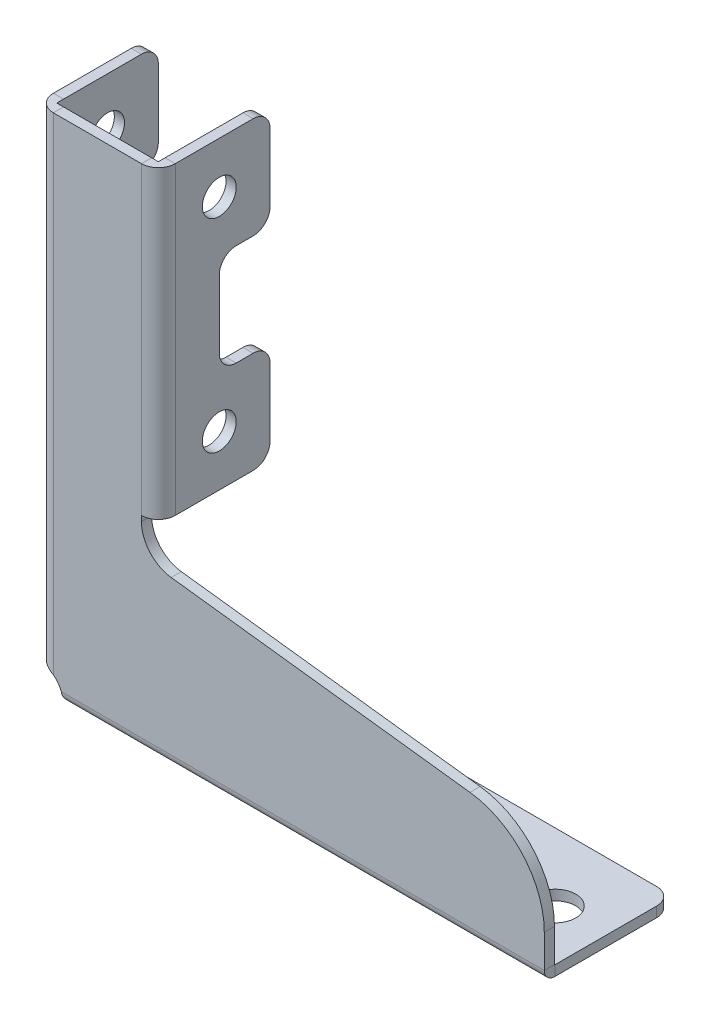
SolidWorks part; units mm, degrees
ref_plane "正面" through (0, 0, 0) normal (0, 0, 1) x (1, 0, 0)
ref_plane "平面" through (0, 0, 0) normal (0, 1, 0) x (1, 0, 0)
ref_plane "右側面" through (0, 0, 0) normal (1, 0, 0) x (0, 0, -1)
sketch "ｽｹｯﾁ1" plane through (0, 0, 0) normal (0, 0, 1) x (1, 0, 0)
  line L0 (114.2253, 30.6675) -> (25.9598, 41.5051)
  line L1 (-42.3215, 142.9719) -> (50.6785, 142.9719)
  line L2 (-10.8215, -41.5281) -> (-10.8215, -13.6953)
  line L3 (136.1785, 5.8538) -> (136.1785, -41.5281)
  line L4 (-42.3215, 142.9719) -> (-42.3215, -4.0281)
  line L5 (-42.3215, -4.0281) -> (-20.4887, -4.0281)
  line L7 (17.1785, 52.9719) -> (50.6785, 52.9719)
  line L8 (17.1785, 52.9719) -> (17.1785, 51.4306)
  line L9 (-10.8215, -41.5281) -> (136.1785, -41.5281)
  line L10 (-42.3215, -4.0281) -> (50.6785, -4.0281) construction
  line L11 (50.6785, 142.9719) -> (50.6785, 52.9719)
  arc A0 (25.9598, 41.5051) -> (17.1785, 51.4306) centre (27.1785, 51.4306) cw
  arc A1 (136.1785, 5.8538) -> (114.2253, 30.6675) centre (111.1785, 5.8538) ccw
  arc A2 (-10.8215, -13.6953) -> (-20.4887, -4.0281) centre (-13.4731, -6.6797) ccw
  dimension "D1" = 31.5
  dimension "D8" = 97
  dimension "D9" = 10
  dimension "D10" = 25
  dimension "D2" = 147
  dimension "D3" = 33.5
  dimension "D4" = 37.5
  dimension "D5" = 90
  dimension "D6" = 147
sheet metal parameters "板金1" thickness 3 parameters "D1"=0.7366
base flange "ﾍﾞｰｽ-ﾌﾗﾝｼﾞ1" sketch "ｽｹｯﾁ1" thickness 3 reverse thickness direction yes parameters "D1"=0.7366
sketch "ｽｹｯﾁ3" plane through (0, 0, 0) normal (0, 0, -1) x (-1, 0, 0)
  line L0 (-22.1785, 52.9719) -> (-22.1785, 142.9719)
  line L1 (-17.1785, 52.9719) -> (-50.6785, 52.9719) construction
  line L2 (-50.6785, 142.9719) -> (42.3215, 142.9719) construction
  line L4 (-17.1785, 51.4306) -> (-17.1785, 52.9719) construction
  dimension "D1" = 5
sketched bend "ｽｹｯﾁ ﾍﾞﾝﾄﾞ2" parameters "D1"=2
bend "ｽｹｯﾁﾍﾞﾝﾄﾞ2" bend radius 2 bend angle 90 parameters "D5"=1
sketch "ｽｹｯﾁ13" plane through (0, 0, 0) normal (0, 0, -1) x (-1, 0, 0)
  line L0 (13.8215, 142.9719) -> (13.8215, 27.9719)
  line L1 (-17.1785, 142.9719) -> (42.3215, 142.9719) construction
  line L2 (10.8215, -13.6953) -> (10.8215, -41.5281) construction
  dimension "D1" = 3
sketched bend "ｽｹｯﾁ ﾍﾞﾝﾄﾞ5" parameters "D1"=2
bend "ｽｹｯﾁﾍﾞﾝﾄﾞ5" bend radius 2 bend angle 90 parameters "D5"=2
sketch "ｽｹｯﾁ14" plane through (0, 0, 0) normal (0, 0, -1) x (-1, 0, 0)
  line L0 (-136.1785, -7.0281) -> (10.8215, -7.0281)
  line L1 (-136.1785, -41.5281) -> (-136.1785, 5.8538) construction
  line L2 (10.8215, -13.6953) -> (10.8215, -41.5281) construction
  line L4 (13.8215, -4.0281) -> (10.8215, -4.0281) construction
  dimension "D1" = 3
sketched bend "ｽｹｯﾁ ﾍﾞﾝﾄﾞ19" parameters "D1"=0.1
bend "ｽｹｯﾁﾍﾞﾝﾄﾞ19" bend radius 0.1 bend angle 90 parameters "D5"=3
hole_wizard "Ø12.2 (12.2) 直径の穴1" positions "3Dｽｹｯﾁ1" profile "ｽｹｯﾁ8" hole size "Ø12.2" standard "JIS"
sketch3d "3Dｽｹｯﾁ1"
  line L4 (-10.8215, -4.0281, -35.1867) -> (136.1785, -4.0281, -35.1867) construction
  line L5 (136.1785, -4.0281, -35.1867) -> (136.1785, -4.0281, -0.1) construction
  point P21 (61.1785, -4.0281, -15.1867)
  point P23 (121.1785, -4.0281, -15.1867)
  dimension "D1" = 20
  dimension "D2" = 15
  dimension "D3" = 60
sketch "ｽｹｯﾁ8" plane through (61.1785, -4.0281, -15.1867) normal (1, 0, 0) x (0, 0, 1)
  line L0 (0, 0) -> (0, 39.6652)
  line L1 (0, 39.6652) -> (6.1, 36)
  line L2 (6.1, 36) -> (6.1, 0)
  line L5 (6.1, 0) -> (0, 0)
  line L10 (0, 39.6652) -> (-6.1, 36) construction
  line L11 (0, -6.35) -> (0, 107.95) construction
  dimension "穴の直径" = 12.2
  dimension "穴の深さ" = 36
  dimension "ﾄﾞﾘﾙ角度" = 118
hole_wizard "Ø10.0 (10) 直径の穴1" positions "ｽｹｯﾁ10" profile "ｽｹｯﾁ9" hole size "Ø10.0" standard "JIS"
sketch "ｽｹｯﾁ10" plane through (22.1785, 0, 0) normal (1, 0, 0) x (0, 0, -1)
  line L0 (30.0022, 52.9719) -> (30.0022, 142.9719) construction
  line L1 (30.0022, 142.9719) -> (2, 142.9719) construction
  point P0 (15.0022, 127.9719)
  point P1 (15.0022, 67.9719)
  dimension "D1" = 15
  dimension "D2" = 15
  dimension "D3" = 60
sketch "ｽｹｯﾁ9" plane through (22.1785, 127.9719, -15.0022) normal (0, 1, 0) x (0, 0, -1)
  line L0 (0, 0) -> (0, 39.0043)
  line L1 (0, 39.0043) -> (5, 36)
  line L2 (5, 36) -> (5, 0)
  line L5 (5, 0) -> (0, 0)
  line L10 (0, 39.0043) -> (-5, 36) construction
  line L11 (0, -6.35) -> (0, 107.95) construction
  dimension "穴の直径" = 10
  dimension "穴の深さ" = 36
  dimension "ﾄﾞﾘﾙ角度" = 118
sketch "ｽｹｯﾁ15" plane through (-13.8215, 0, 0) normal (-1, 0, 0) x (0, 0, 1)
  line L0 (-30.0022, 142.9719) -> (-30.0022, -4.0281) construction
  line L1 (-30.0022, 112.9719) -> (-15.0022, 112.9719)
  line L2 (-30.0022, 112.9719) -> (-30.0022, 82.9719)
  line L3 (-30.0022, 82.9719) -> (-15.0022, 82.9719)
  line L4 (-15.0022, 112.9719) -> (-15.0022, 82.9719)
  line L6 (-30.0022, 142.9719) -> (-30.0022, -4.0281) construction
  line L7 (-30.0022, 52.9719) -> (-15.0022, 52.9719)
  line L8 (-30.0022, 52.9719) -> (-30.0022, -4.0281)
  line L9 (-30.0022, -4.0281) -> (-15.0022, -4.0281)
  line L10 (-15.0022, 52.9719) -> (-15.0022, -4.0281)
  line L11 (-30.0022, -4.0281) -> (-8.1695, -4.0281) construction
  circle A0 centre (-15.0022, 127.9719) radius 5 construction
  circle A1 centre (-15.0022, 67.9719) radius 5 construction
  dimension "D1" = 15
  dimension "D4" = 15
  dimension "D2" = 15
  dimension "D3" = 15
  dimension "D5" = 15
extrude "押し出し1" cut sketch "ｽｹｯﾁ15" against normal through all
fillet "ﾌｨﾚｯﾄ2" radius 5 15 edges at (20.6785, 52.9719, -30.0022) (20.6785, 142.9719, -30.0022) (-12.3215, 142.9719, -30.0022) (136.1785, -5.5281, -35.1867) (-10.8215, -5.5281, -35.1867) (-12.3215, 82.9719, -30.0022) (-12.3215, 82.9719, -15.0022) (-12.3215, 112.9719, -30.0022) (-12.3215, 112.9719, -15.0022) (20.6785, 112.9719, -30.0022) (20.6785, 112.9719, -15.0022) (20.6785, 82.9719, -15.0022) (20.6785, 82.9719, -30.0022) (-12.3215, 52.9719, -15.0022) (-12.3215, 52.9719, -30.0022)
sketch "ｽｹｯﾁ16" plane through (0, 142.9719, 0) normal (0, 1, 0) x (1, 0, 0)
  line L0 (-10.8215, 2) -> (-10.8215, 0)
  line L1 (-8.8215, 0) -> (-10.8215, 0)
  line L2 (17.1785, 0) -> (19.1785, 0)
  line L3 (19.1785, 2) -> (19.1785, 0)
  arc A0 (-10.8215, 2) -> (-8.8215, 0) centre (-8.8215, 2) ccw construction
  arc A1 (-10.8215, 2) -> (-8.8215, 0) centre (-8.8215, 2) ccw
  arc A2 (17.1785, 0) -> (19.1785, 2) centre (17.1785, 2) ccw construction
  arc A3 (17.1785, 0) -> (19.1785, 2) centre (17.1785, 2) ccw
extrude "ｶｯﾄ - 押し出し4" cut sketch "ｽｹｯﾁ16" against normal up to next
flat pattern "ﾌﾗｯﾄ-ﾊﾟﾀｰﾝ1"
sketch "ﾍﾞﾝﾄﾞ-ﾗｲﾝ1" plane through (0, 0, 0) normal (0, 1, 0) x (-1, 0, 0)
bend of the flat pattern "ﾌﾗｯﾄ-<ｽｹｯﾁﾍﾞﾝﾄﾞ2>1"
bend of the flat pattern "ﾌﾗｯﾄ-<ｽｹｯﾁﾍﾞﾝﾄﾞ5>1"
bend of the flat pattern "ﾌﾗｯﾄ-<ｽｹｯﾁﾍﾞﾝﾄﾞ19>1"
